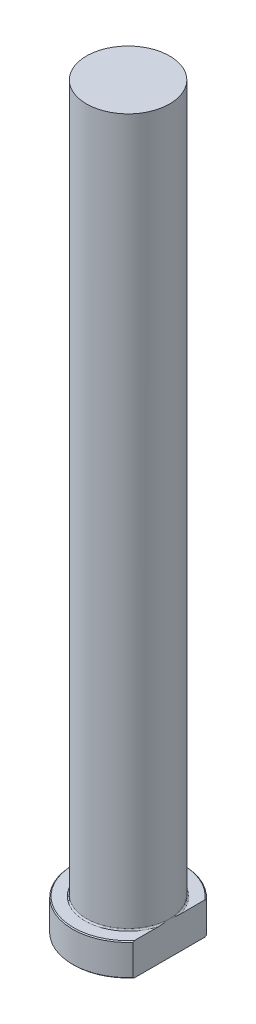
SolidWorks part; units mm, degrees
ref_plane "Front Plane" through (0, 0, 0) normal (0, 0, 1) x (1, 0, 0)
ref_plane "Top Plane" through (0, 0, 0) normal (0, 1, 0) x (1, 0, 0)
ref_plane "Right Plane" through (0, 0, 0) normal (1, 0, 0) x (0, 0, -1)
sketch "Sketch1" plane through (0, 0, 0) normal (0, 0, 1) x (1, 0, 0)
  line L0 (0, 259.9588) -> (0, -15.1925) construction
  line L1 (0, 0) -> (-12, 0)
  line L2 (-12, 0) -> (-12, 7)
  line L3 (-12, 7) -> (-9, 7)
  line L4 (-9, 7) -> (-9, 160)
  line L5 (-9, 160) -> (0, 160)
  line L6 (0, 160) -> (0, 0)
  dimension "L" = 160
  dimension "H" = 24
  dimension "T" = 7
  dimension "D" = 18
revolve "Revolve1" add sketch "Sketch1" angle 360 about L0
chamfer "Chamfer1" distance 0.2 angle 45 2 edges at (0, 7, 12) (0, 0, 12)
fillet "Fillet1" radius 0.3 1 edges at (0, 7, 9)
sketch "Sketch2" plane through (0, 0, 0) normal (0, 1, 0) x (1, 0, 0)
  line L0 (9, 7.9373) -> (9, -7.9373)
  circle A0 centre (0, 0) radius 12 construction
  arc A1 (9, -7.9373) -> (9, 7.9373) centre (0, 0) ccw
  circle A2 centre (0, 0) radius 9 construction
extrude "KEY" cut sketch "Sketch2" along normal through all
